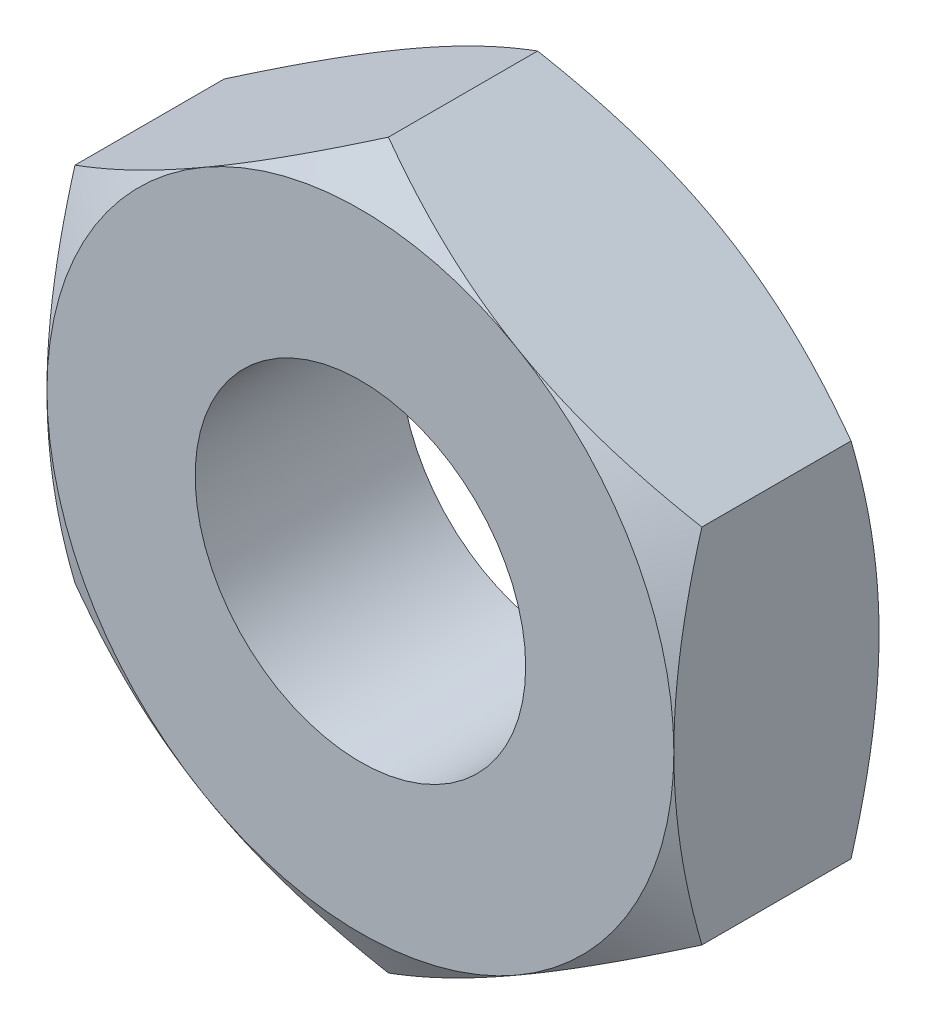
SolidWorks part; units mm, degrees
ref_plane "Plane1" through (0, 0, 0) normal (0, 0, 1) x (1, 0, 0)
ref_plane "Plane2" through (0, 0, 0) normal (0, 1, 0) x (1, 0, 0)
ref_plane "Plane3" through (0, 0, 0) normal (1, 0, 0) x (0, 0, -1)
sketch "BaseNutSke" plane through (0, 0, 0) normal (0, 0, 1) x (1, 0, 0)
  line L6 (2.75, 1.5877) -> (2.75, -1.5877)
  line L7 (-2.75, 1.5877) -> (-2.75, -1.5877)
  line L8 (2.75, 1.5877) -> (0, 3.1754)
  line L9 (0, 3.1754) -> (-2.75, 1.5877)
  line L10 (-2.75, -1.5877) -> (0, -3.1754)
  line L11 (0, -3.1754) -> (2.75, -1.5877)
  dimension "D1" = 120
  dimension "D2" = 2.75
  dimension "D3" = 2.75
  dimension "Width_flats" = 5.5
extrude "BaseNut" add sketch "BaseNutSke" against normal blind 1.8
sketch "Sketch3" plane through (0, 0, 0) normal (1, 0, 0) x (0, 0, -1)
  line L0 (1.8, 2.75) -> (1.5544, 3.1754)
  line L1 (1.5544, 3.1754) -> (1.5544, 13.1754)
  line L2 (1.5544, 13.1754) -> (11.8, 13.1754)
  line L3 (11.8, 13.1754) -> (11.8, 2.75)
  line L4 (11.8, 2.75) -> (1.8, 2.75)
  line L5 (1.8, 1.5877) -> (1.8, 3.1754) construction
  line L6 (1.8, 3.1754) -> (0, 3.1754) construction
  line L7 (0, 0) -> (38.6776, 0) construction
  line L9 (0.9, 3.1754) -> (0.9, 44.222) construction
  line L10 (0.2456, 13.1754) -> (-10, 13.1754)
  line L11 (-10, 13.1754) -> (-10, 2.75)
  line L12 (-10, 2.75) -> (0, 2.75)
  line L13 (0, 2.75) -> (0.2456, 3.1754)
  line L14 (0.2456, 3.1754) -> (0.2456, 13.1754)
  line L16 (1.8, 3.1754) -> (0, 3.1754) construction
  dimension "D1" = 2.75
  dimension "D2" = 30
  dimension "D3" = 10
  dimension "D4" = 10
revolve "Double-Chamfer" cut sketch "Sketch3" angle 360 about L7
hole_wizard "Trou taraudé M3.5x0.61" positions "Esquisse2" profile "Esquisse1" tap size "M3.5x0.6" standard "ISO"
sketch "Esquisse2" plane through (0, 0, 0) normal (0, 0, 1) x (1, 0, 0)
  point P0 (0, 0)
sketch "Esquisse1" plane through (0, 0, 0) normal (1, 0, 0) x (0, -1, 0)
  line L0 (0, 0) -> (0, 1.8)
  line L1 (0, 1.8) -> (1.45, 1.8)
  line L2 (1.45, 1.8) -> (1.45, 0)
  line L5 (1.45, 0) -> (0, 0)
  line L11 (0, -6.35) -> (0, 107.95) construction
  dimension "Diamètre du trou pour taraudage jusqu'au prochain" = 2.9
  dimension "Profondeur du trou pour taraudage jusqu'au prochain" = 1.8
